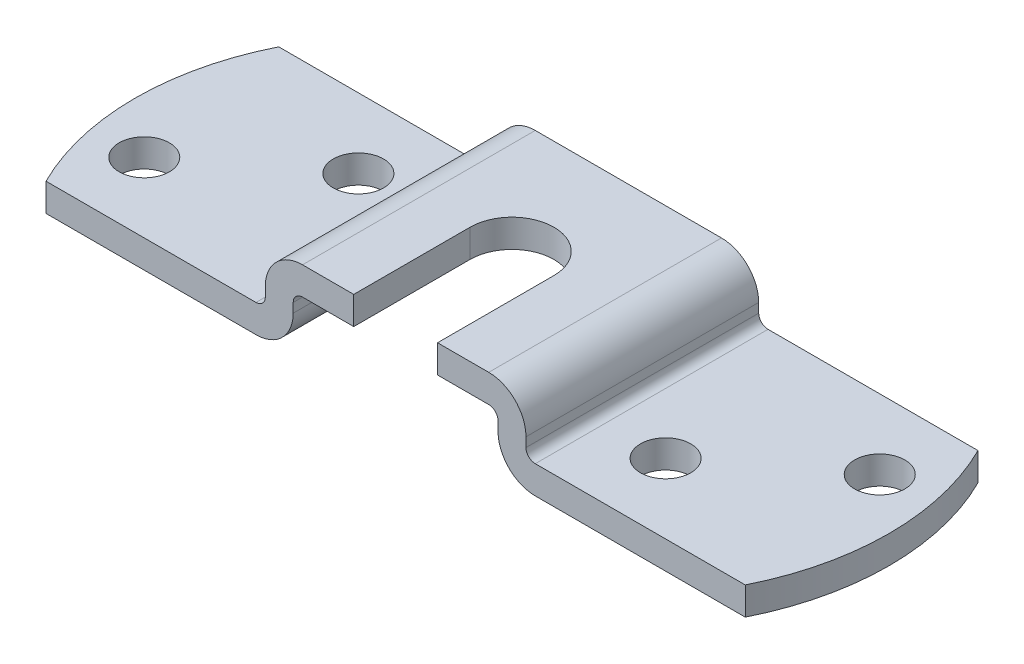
SolidWorks part; units mm, degrees
ref_plane "Front" through (0, 0, 0) normal (0, 0, 1) x (1, 0, 0)
ref_plane "Top" through (0, 0, 0) normal (0, 1, 0) x (1, 0, 0)
ref_plane "Right" through (0, 0, 0) normal (1, 0, 0) x (0, 0, -1)
sketch "Sketch1" plane through (0, 0, 0) normal (0, 0, 1) x (1, 0, 0)
  line L0 (10, 0) -> (-10, 0)
  line L1 (14, -4) -> (14, -5)
  line L2 (15, -6) -> (40.5, -6)
  line L3 (0, 7.1054) -> (0, -18.3455) construction
  line L4 (-15, -6) -> (-40.5, -6)
  line L5 (-14, -4) -> (-14, -5)
  line L6 (-15, -9) -> (-40.5, -9)
  line L7 (-11, -4) -> (-11, -5)
  line L8 (10, -3) -> (-10, -3)
  line L9 (11, -4) -> (11, -5)
  line L10 (15, -9) -> (40.5, -9)
  line L11 (-40.5, -6) -> (-40.5, -9)
  line L12 (40.5, -6) -> (40.5, -9)
  arc A0 (10, 0) -> (14, -4) centre (10, -4) cw
  arc A1 (14, -5) -> (15, -6) centre (15, -5) ccw
  arc A2 (-10, 0) -> (-14, -4) centre (-10, -4) ccw
  arc A3 (-14, -5) -> (-15, -6) centre (-15, -5) cw
  arc A4 (-11, -5) -> (-15, -9) centre (-15, -5) cw
  arc A5 (-10, -3) -> (-11, -4) centre (-10, -4) ccw
  arc A6 (10, -3) -> (11, -4) centre (10, -4) cw
  arc A7 (11, -5) -> (15, -9) centre (15, -5) ccw
  point P19 (0, 0)
  dimension "D3" = 4
  dimension "D5" = 28
  dimension "D4" = 1
  dimension "D1" = 81
  dimension "D2" = 6
  dimension "D6" = 3
extrude "Extrude1" add sketch "Sketch1" along normal blind 25
sketch "Sketch2" plane through (0, -6, 0) normal (0, 1, 0) x (1, 0, 0)
  line L0 (-40.5, -25) -> (-40.5, 0) construction
  line L1 (-15, 0) -> (-40.5, 0) construction
  line L2 (-37.5549, 0) -> (-40.5, 0)
  line L3 (-40.5, -25) -> (-40.5, 0)
  line L4 (-15, -25) -> (-40.5, -25) construction
  line L5 (-37.5549, -25) -> (-40.5, -25)
  line L6 (0, 11.4771) -> (0, -38.2752) construction
  line L7 (37.5549, -25) -> (40.5, -25)
  line L8 (40.5, -25) -> (40.5, 0)
  line L9 (37.5549, 0) -> (40.5, 0)
  arc A0 (-37.5549, 0) -> (-37.5549, -25) centre (-12.5, -12.5) ccw
  arc A1 (37.5549, 0) -> (37.5549, -25) centre (12.5, -12.5) cw
  point P4 (-40.5, -12.5)
  dimension "D1" = 56
extrude "Extrude3" cut sketch "Sketch2" against normal through all contours A0 L3 M1 | A0 M2 M3 | L9 A1 L8 | L8 A1 L7
sketch "Sketch3" plane through (0, 0, 0) normal (0, 1, 0) x (1, 0, 0)
  line L0 (0, 10.832) -> (0, -30.2425) construction
  line L1 (-4.5, -25) -> (-4.5, -12.5)
  line L2 (10, -25) -> (-10, -25) construction
  line L3 (4.5, -12.5) -> (4.5, -25)
  line L4 (4.5, -25) -> (-4.5, -25)
  arc A0 (-4.5, -12.5) -> (4.5, -12.5) centre (0, -12.5) cw
  dimension "D2" = 17
  dimension "D1" = 9
extrude "Extrude4" cut sketch "Sketch3" against normal through all
sketch "Sketch4" plane through (0, -6, 0) normal (0, 1, 0) x (1, 0, 0)
  line L0 (0, 10.2382) -> (0, -40.3215) construction
  line L1 (-15, 0) -> (-37.5549, 0) construction
  circle A0 centre (-34.5, -17.5) radius 2.7
  circle A1 centre (-21.5, -7.5) radius 2.7
  circle A2 centre (21.5, -17.5) radius 2.7
  circle A3 centre (34.5, -7.5) radius 2.7
  dimension "D1" = 5.4
  dimension "D2" = 13
  dimension "D3" = 13
  dimension "D4" = 56
  dimension "D5" = 7.5
  dimension "D6" = 10
  dimension "D7" = 43
extrude "Extrude5" cut sketch "Sketch4" against normal through all
